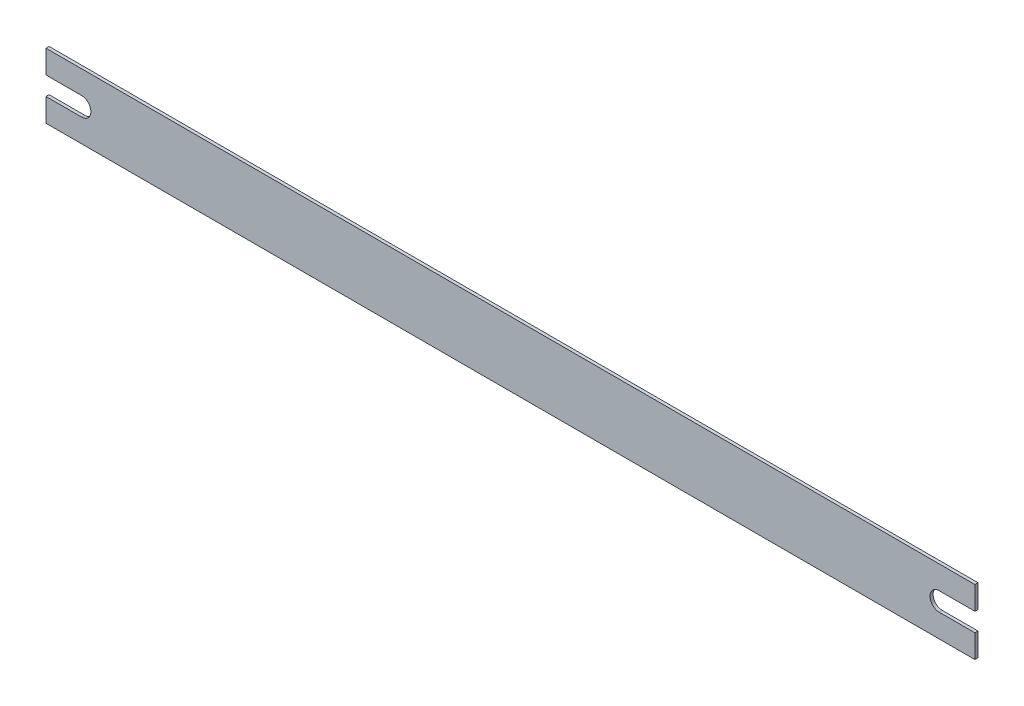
SolidWorks part; units mm, degrees
ref_plane "Vorne" through (0, 0, 0) normal (0, 0, 1) x (1, 0, 0)
ref_plane "Oben" through (0, 0, 0) normal (0, 1, 0) x (1, 0, 0)
ref_plane "Links" through (0, 0, 0) normal (1, 0, 0) x (0, 0, -1)
sketch "Skizze1" plane through (0, 0, 0) normal (0, 0, 1) x (1, 0, 0)
  line L0 (-15, 37.5) -> (57.5, 37.5)
  line L1 (0, 0) -> (1500, 0)
  line L2 (0, 0) -> (0, 105)
  line L3 (0, 105) -> (1500, 105)
  line L4 (1500, 0) -> (1500, 105)
  line L5 (-15, 67.5) -> (57.5, 67.5)
  line L6 (-15, 67.5) -> (-15, 37.5)
  line L7 (-15, 52.5) -> (1545, 52.5) construction
  line L8 (1545, 67.5) -> (1545, 37.5)
  line L9 (1442.5, 37.5) -> (1545, 37.5)
  line L10 (1442.5, 67.5) -> (1545, 67.5)
  arc A0 (57.5, 37.5) -> (57.5, 67.5) centre (57.5, 52.5) ccw
  arc A1 (1442.5, 67.5) -> (1442.5, 37.5) centre (1442.5, 52.5) ccw
  point P10 (57.5, 52.5)
  point P12 (1442.5, 52.5)
  dimension "D1" = 1500
  dimension "D2" = 105
  dimension "D3" = 1560
  dimension "D4" = 15
  dimension "D5" = 37.5
  dimension "D6" = 30
  dimension "D7" = 57.5
  dimension "D8" = 57.5
extrude "Linear austragen1" add sketch "Skizze1" along normal blind 5 contours L7 A0 L0 L2 L1 L4 L9 A1 | A0 L7 A1 L10 L4 L3 L2 L5
